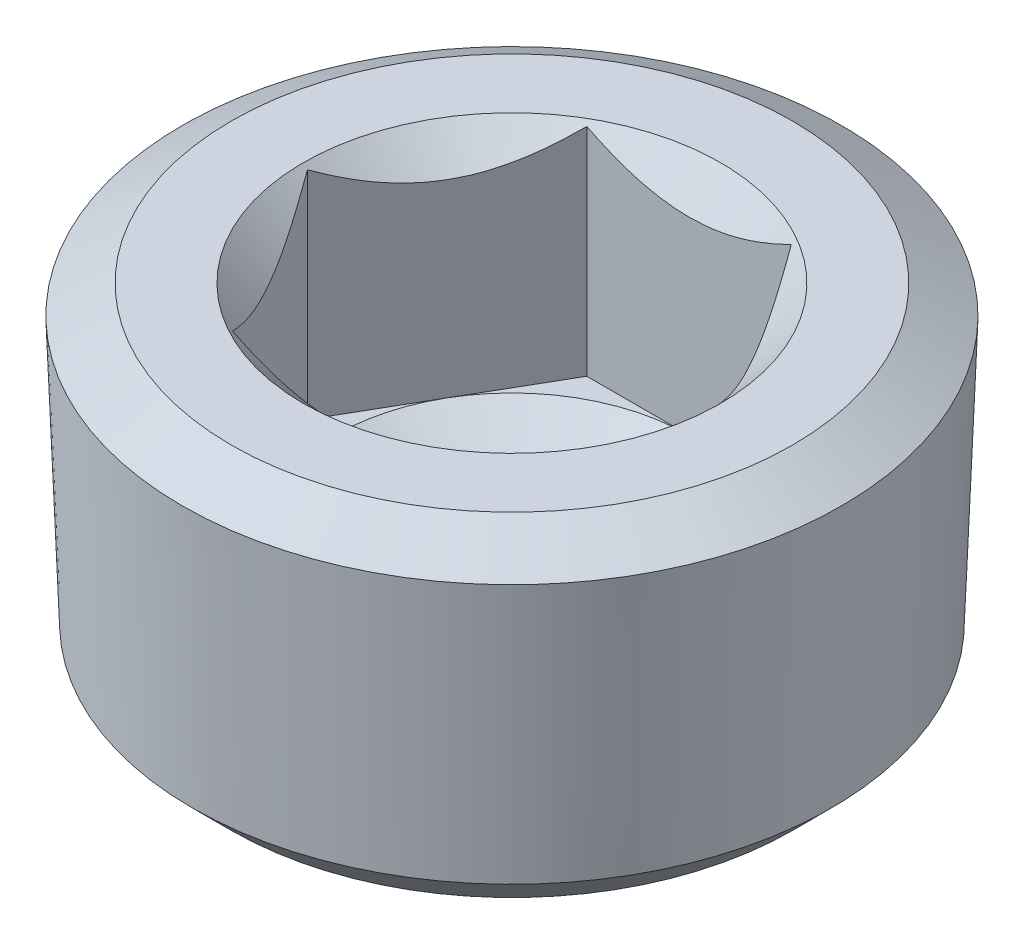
SolidWorks part; units mm, degrees
ref_plane "Front Plane" through (0, 0, 0) normal (0, 0, 1) x (1, 0, 0)
ref_plane "Top Plane" through (0, 0, 0) normal (0, 1, 0) x (1, 0, 0)
ref_plane "Right Plane" through (0, 0, 0) normal (1, 0, 0) x (0, 0, -1)
sketch "Sketch2" plane through (0, 0, 0) normal (0, 0, 1) x (1, 0, 0)
  line L0 (0, 10.7443) -> (0, -17.0657) construction
  line L1 (0, 0) -> (-11.3202, 0)
  line L2 (-13.2935, -1.1393) -> (-12.9019, -11.8803)
  line L3 (-11.3202, -13.462) -> (0, -13.462)
  line L4 (0, -13.462) -> (0, 0)
  line L6 (-11.3202, -13.462) -> (-12.9019, -11.8803)
  line L7 (-11.3202, 0) -> (-13.2935, -1.1393)
  point P4 (-13.335, 0)
  point P6 (-12.8442, -13.462)
  dimension "D1" = 13.462
  dimension "D2" = 2.088
  dimension "D3" = 26.67
  dimension "D4" = 30
  dimension "D5" = 1.524
  dimension "D6" = 45
revolve "Revolve1" add sketch "Sketch2" angle 360 about L0
sketch "Sketch3" plane through (0, 0, 0) normal (0, 0, 1) x (1, 0, 0)
  line L0 (0, 2.9342) -> (0, -8.1202) construction
  line L1 (0, 0) -> (-8.4137, 0)
  line L2 (11.3202, 0) -> (-11.3202, 0) construction
  line L3 (-7.1437, -1.27) -> (-7.1437, -8.89)
  line L4 (-7.1437, -8.89) -> (-5.0301, -10.16)
  line L5 (0, -10.16) -> (0, 0)
  line L6 (-7.1437, -1.27) -> (-8.4137, 0)
  line L7 (-5.0301, -10.16) -> (0, -10.16)
  dimension "D1" = 8.89
  dimension "D2" = 59
  dimension "D3" = 14.2875
  dimension "D4" = 1.27
  dimension "D5" = 45
  dimension "D6" = 10.16
revolve "Cut-Revolve1" cut sketch "Sketch3" angle 360 about L0
sketch "Sketch4" plane through (0, 0, 0) normal (0, 1, 0) x (1, 0, 0)
  line L1 (-4.1244, -7.1437) -> (4.1244, -7.1437)
  line L2 (4.1244, -7.1437) -> (8.2489, 0)
  line L3 (8.2489, 0) -> (4.1244, 7.1437)
  line L4 (4.1244, 7.1437) -> (-4.1244, 7.1437)
  line L5 (-4.1244, 7.1437) -> (-8.2489, 0)
  line L6 (-8.2489, 0) -> (-4.1244, -7.1437)
  circle A0 centre (0, 0) radius 7.1437 construction
  circle A1 centre (0, 0) radius 7.1437 construction
extrude "Cut-Extrude1" cut sketch "Sketch4" against normal up to vertex (5.2929 mm away)
